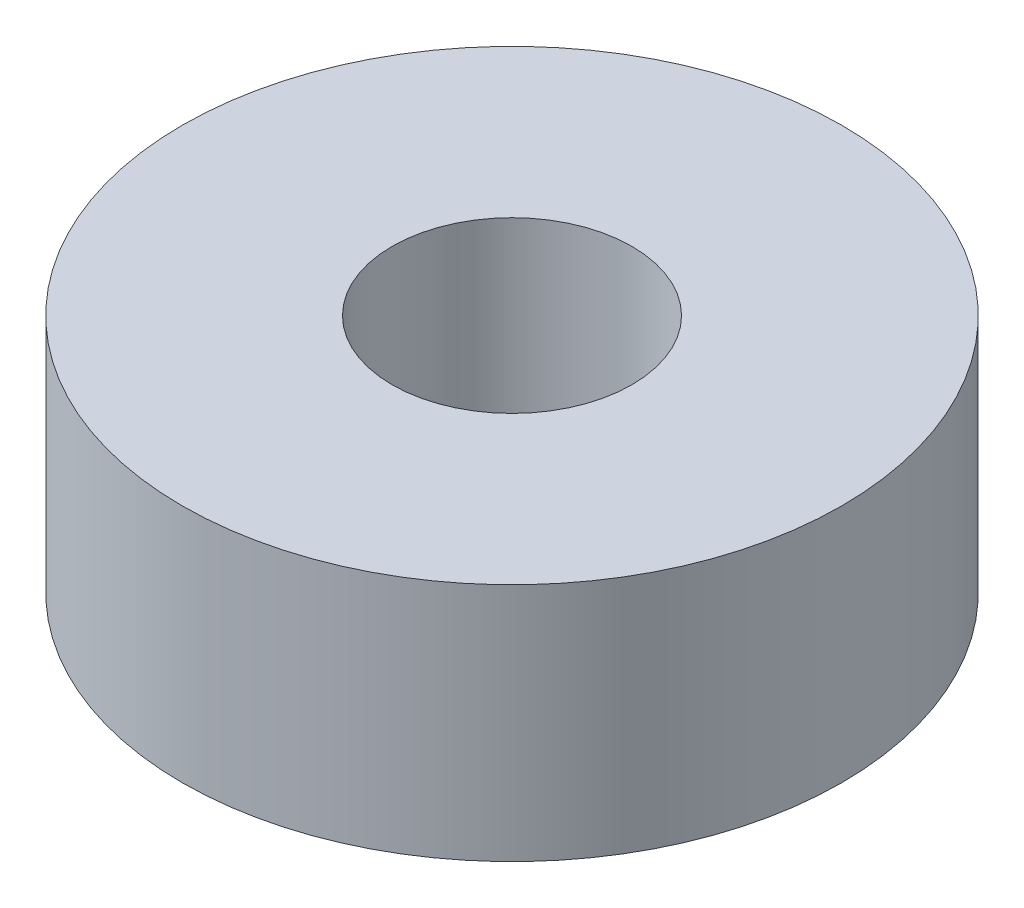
SolidWorks part; units mm, degrees
ref_plane "Front Plane" through (0, 0, 0) normal (0, 0, 1) x (1, 0, 0)
ref_plane "Top Plane" through (0, 0, 0) normal (0, 1, 0) x (1, 0, 0)
ref_plane "Right Plane" through (0, 0, 0) normal (1, 0, 0) x (0, 0, -1)
sketch "Sketch1" plane through (0, 0, 0) normal (0, 1, 0) x (1, 0, 0)
  circle A0 centre (0, 0) radius 11
  dimension "D1" = 22
extrude "Boss-Extrude1" add sketch "Sketch1" along normal blind 8
sketch "Sketch2" plane through (0, 8, 0) normal (0, 1, 0) x (1, 0, 0)
  circle A0 centre (0, 0) radius 4
  dimension "D1" = 8
extrude "Cut-Extrude1" cut sketch "Sketch2" against normal through all
